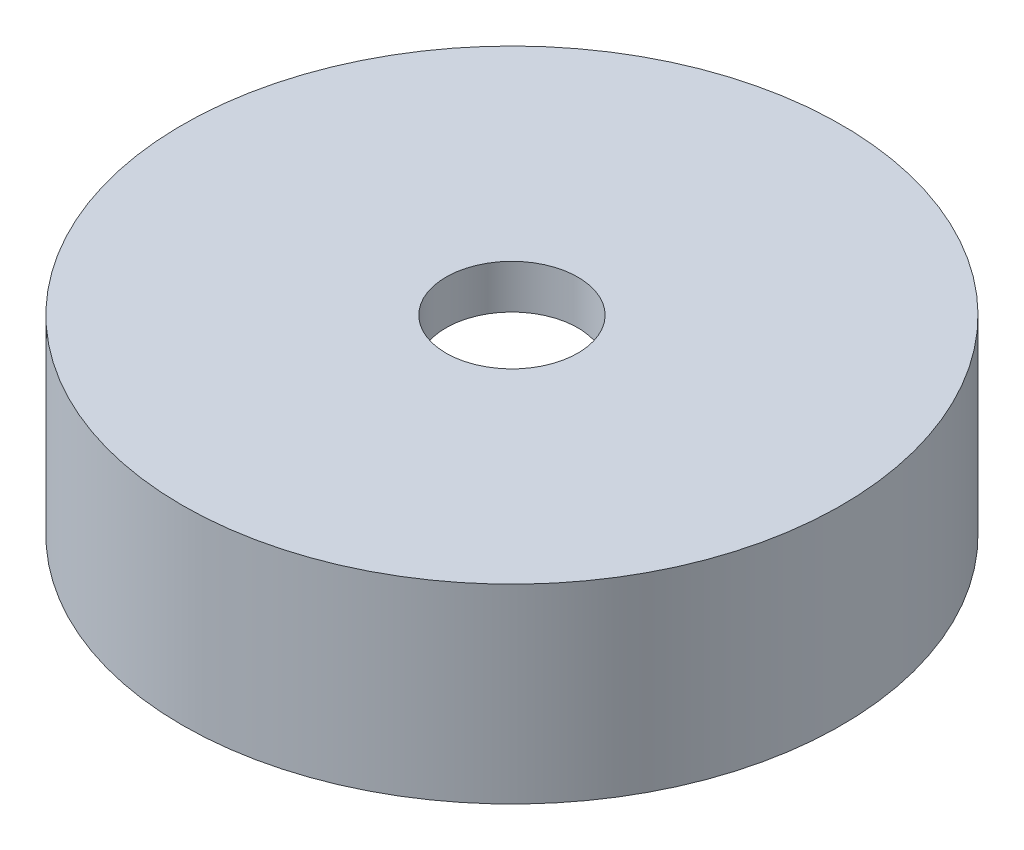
SolidWorks part; units mm, degrees
ref_plane "face" through (0, 0, 0) normal (0, 0, 1) x (1, 0, 0)
ref_plane "dessus" through (0, 0, 0) normal (0, 1, 0) x (1, 0, 0)
ref_plane "profil" through (0, 0, 0) normal (1, 0, 0) x (0, 0, -1)
sketch "Esquisse1" plane through (0, 0, 0) normal (0, 0, 1) x (1, 0, 0)
  line L0 (0, 34.1842) -> (0, -19.7908) construction
  line L1 (4.5, 13) -> (22.5, 13)
  line L3 (22.5, 13) -> (22.5, 0)
  line L4 (22.5, 0) -> (19.5, 0)
  line L5 (19.5, 0) -> (19.5, 10)
  line L6 (19.5, 10) -> (4.5, 10)
  line L7 (4.5, 10) -> (4.5, 13)
  dimension "D1" = 22.5
  dimension "D2" = 3
  dimension "D3" = 3
  dimension "D4" = 10
  dimension "D5" = 4.5
revolve "Base-Révolution" add sketch "Esquisse1" angle 360 about L0
sketch "Esquisse2" plane through (0, 13, 0) normal (0, 1, 0) x (-1, 0, 0)
  line L1 (0, 0) -> (24.0597, 0)
  line L2 (0, 0) -> (0, 24.8799)
  line L3 (0, 24.8799) -> (24.0597, 24.8799)
  line L4 (24.0597, 0) -> (24.0597, 24.8799)
extrude "Enlèv. mat.-Extru.1" cut sketch "Esquisse2" against normal through all
